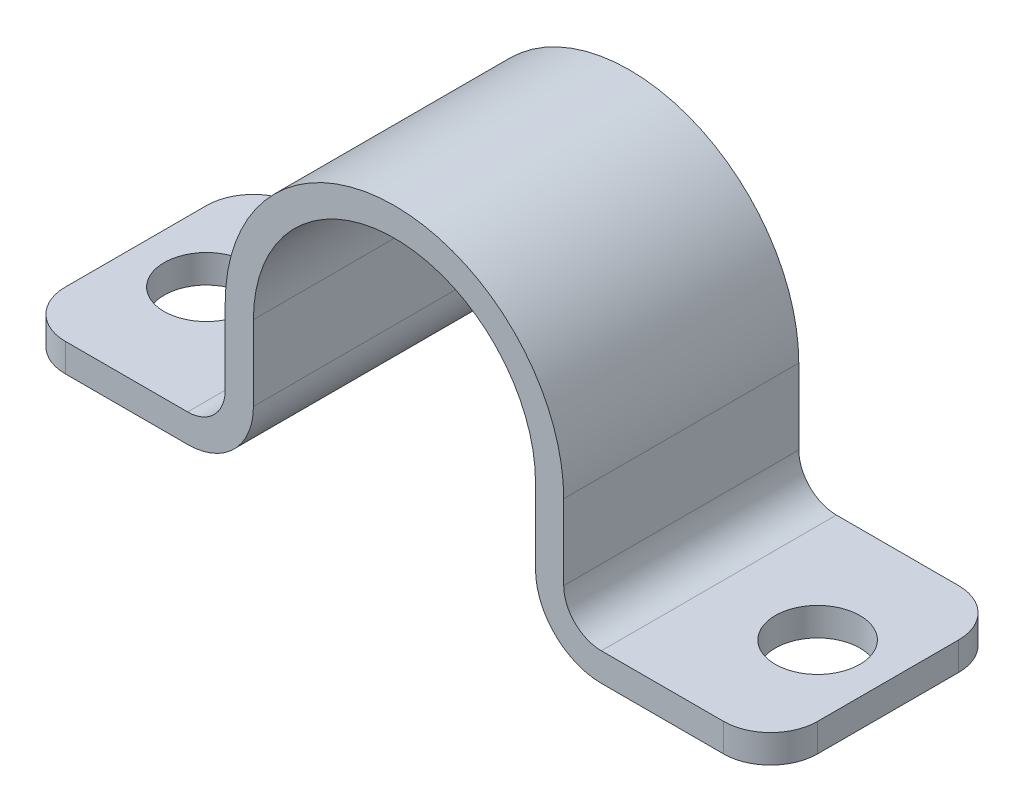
SolidWorks part; units mm, degrees
ref_plane "Plan1" through (0, 0, 0) normal (0, 0, 1) x (1, 0, 0)
ref_plane "Plan2" through (0, 0, 0) normal (0, 1, 0) x (1, 0, 0)
ref_plane "Plan3" through (0, 0, 0) normal (1, 0, 0) x (0, 0, -1)
sketch "Esquisse1" plane through (0, 0, 0) normal (0, 0, 1) x (1, 0, 0)
  line L0 (-92, 0) -> (97, 0) construction
  line L1 (-40, 3) -> (-22, 3)
  line L2 (-40, 3) -> (-40, 0)
  line L3 (40, 0) -> (22, 0)
  line L4 (40, 0) -> (40, 3)
  line L5 (0, 78) -> (0, -27) construction
  line L6 (22, 3) -> (40, 3)
  line L7 (-18, 15) -> (-18, 7)
  line L8 (18, 15) -> (18, 7)
  line L9 (-15, 15) -> (-15, 7)
  line L11 (15, 15) -> (15, 7)
  line L13 (-22, 0) -> (-40, 0)
  arc A0 (15, 15) -> (-15, 15) centre (0, 15) ccw
  arc A1 (18, 15) -> (-18, 15) centre (0, 15) ccw
  arc A2 (-22, 3) -> (-18, 7) centre (-22, 7) ccw
  arc A3 (22, 3) -> (18, 7) centre (22, 7) cw
  arc A4 (-22, 0) -> (-15, 7) centre (-22, 7) ccw
  arc A5 (22, 0) -> (15, 7) centre (22, 7) cw
  point P26 (-15, 0)
  dimension "D3" = 7
  dimension "D4" = 15
  dimension "D5" = 4
  dimension "D6" = 15
  dimension "D8" = 18
  dimension "D1" = 3
  dimension "D2" = 80
  dimension "D7" = 40
extrude "Base-Extrusion" add sketch "Esquisse1" along normal blind 25
fillet "Congé1" radius 5
sketch "Esquisse2" plane through (0, 0, 0) normal (0, -1, 0) x (1, 0, 0)
  line L0 (-32.5, 35) -> (-32.5, -4) construction
  line L1 (32.5, 37) -> (32.5, -6) construction
  line L2 (-22, 25) -> (-35, 25) construction
  circle A0 centre (-32.5, 12.5) radius 4.5
  circle A1 centre (32.5, 12.5) radius 4.5
  dimension "D3" = 9
  dimension "D1" = 65
  dimension "D2" = 32.5
  dimension "D4" = 12.5
extrude "Enlèv. mat.-Extru.1" cut sketch "Esquisse2" against normal through all
